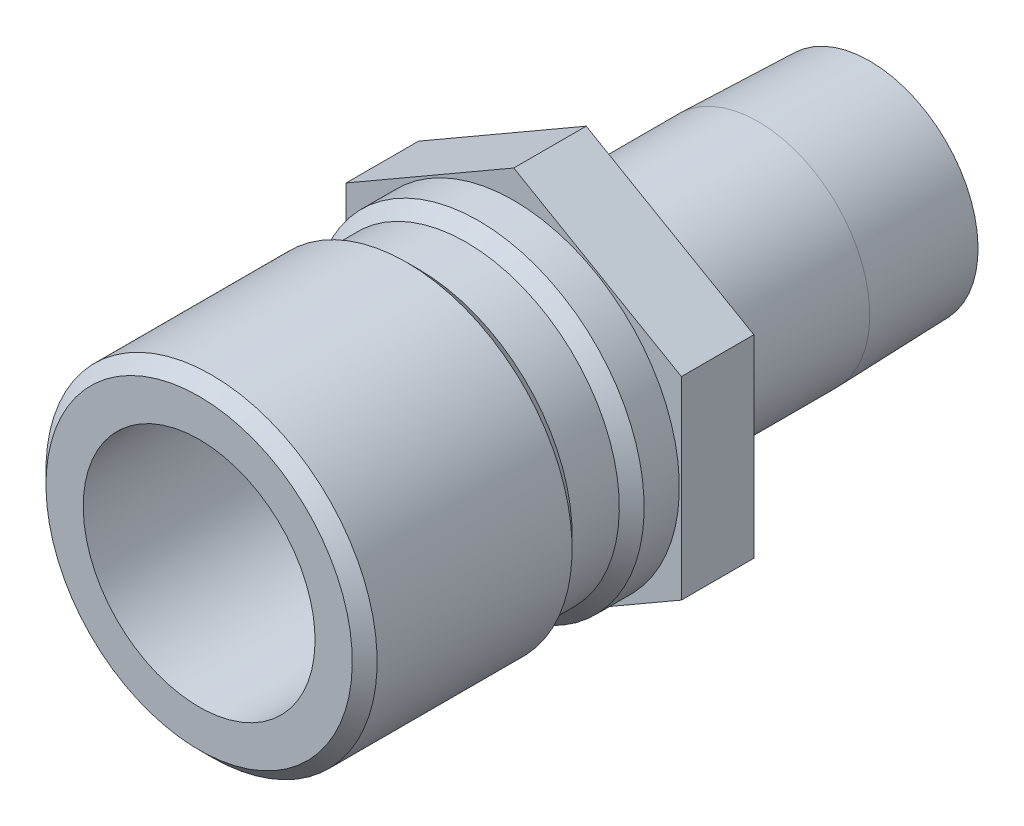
SolidWorks part; units mm, degrees
ref_plane "Front Plane" through (0, 0, 0) normal (0, 0, 1) x (1, 0, 0)
ref_plane "Top Plane" through (0, 0, 0) normal (0, 1, 0) x (1, 0, 0)
ref_plane "Right Plane" through (0, 0, 0) normal (1, 0, 0) x (0, 0, -1)
sketch "Sketch1" plane through (0, 0, 0) normal (1, 0, 0) x (0, 0, -1)
  line L0 (0, 0) -> (-22.479, 0) construction
  line L1 (-19.304, 7.112) -> (-19.304, 9.398)
  line L2 (-5.8166, 9.398) -> (-5.8166, 0) construction
  line L3 (-18.542, 10.16) -> (-6.5786, 10.16)
  line L4 (0, 6.858) -> (0, 0) construction
  line L5 (-5.8166, 9.398) -> (-2.921, 9.398)
  line L6 (-2.159, 10.16) -> (0, 10.16)
  line L7 (0, 10.16) -> (0, 6.858)
  line L8 (-5.8166, 9.398) -> (-6.5786, 10.16)
  line L9 (-2.921, 9.398) -> (-2.159, 10.16)
  line L10 (-19.304, 9.398) -> (-18.542, 10.16)
  line L11 (-0.2747, 4.7625) -> (21.844, 4.7625)
  line L12 (0, 6.858) -> (14.986, 6.858)
  line L13 (14.986, 6.858) -> (21.844, 6.6437)
  line L14 (21.844, 6.6437) -> (21.844, 4.7625)
  line L15 (4.445, 0) -> (0, 0) construction
  line L16 (-19.304, 7.112) -> (-1.524, 7.112)
  line L17 (-1.524, 7.112) -> (-0.2747, 4.7625)
  dimension "D1" = 19.304
  dimension "D2" = 2.8956
  dimension "D3" = 0.762
  dimension "D4" = 45
  dimension "D5" = 13.4874
  dimension "D6" = 45
  dimension "D7" = 1.79
  dimension "D8" = 6.858
  dimension "D9" = 41.148
  dimension "D10" = 3.175
  dimension "D11" = 4.445
  dimension "D12" = 9.525
  dimension "D13" = 13.716
  dimension "D14" = 20.32
  dimension "D15" = 118
  dimension "D16" = 14.224
  dimension "D17" = 17.78
revolve "Revolve1" add sketch "Sketch1" angle 360 about L0
sketch "Sketch2" plane through (0, 0, 0) normal (0, 0, 1) x (1, 0, 0)
  line L1 (-10.287, 5.9392) -> (-10.287, -5.9392)
  line L2 (-10.287, -5.9392) -> (0, -11.8784)
  line L3 (0, -11.8784) -> (10.287, -5.9392)
  line L4 (10.287, -5.9392) -> (10.287, 5.9392)
  line L5 (10.287, 5.9392) -> (0, 11.8784)
  line L6 (0, 11.8784) -> (-10.287, 5.9392)
  circle A0 centre (0, 0) radius 10.287 construction
  circle A1 centre (0, 0) radius 4.7625 construction
  circle A2 centre (0, 0) radius 4.7625
  dimension "D1" = 20.574
extrude "Boss-Extrude1" add sketch "Sketch2" against normal up to vertex (4.445 mm away)
